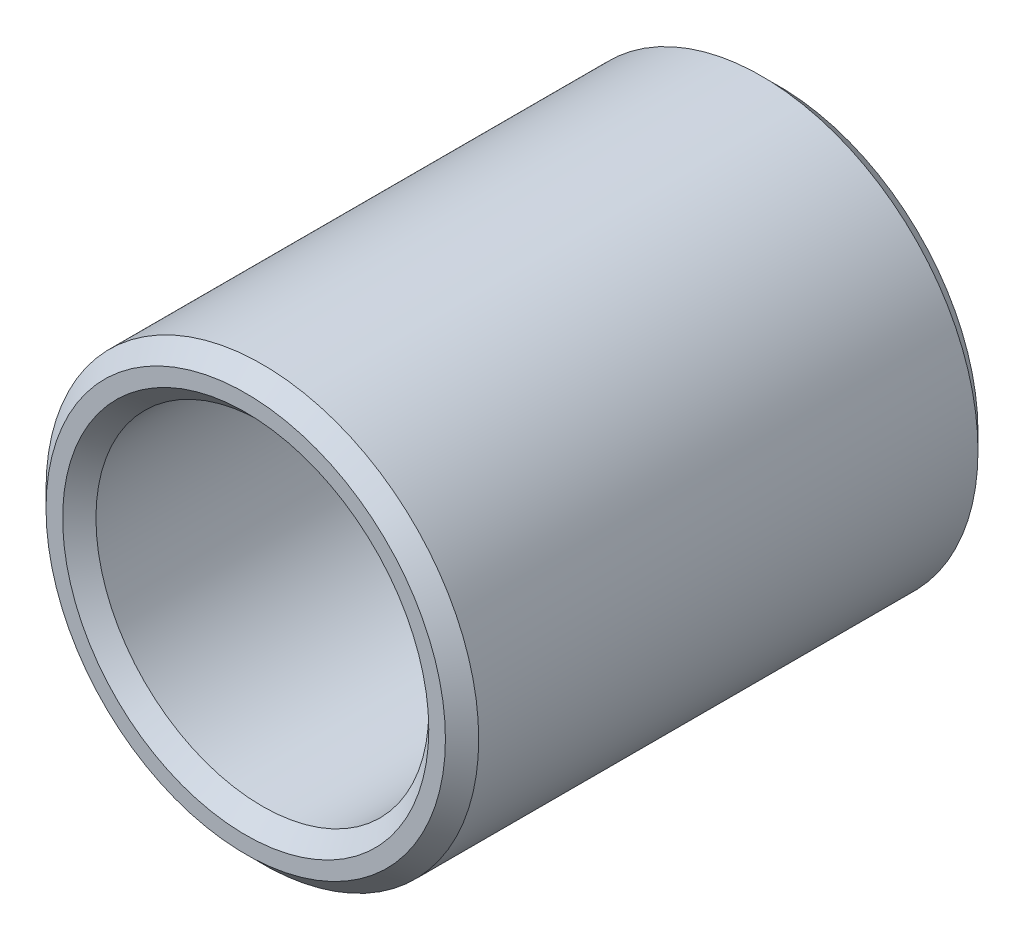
SolidWorks part; units mm, degrees
ref_plane "Plan de face" through (0, 0, 0) normal (0, 0, 1) x (1, 0, 0)
ref_plane "Plan de dessus" through (0, 0, 0) normal (0, 1, 0) x (1, 0, 0)
ref_plane "Plan de droite" through (0, 0, 0) normal (1, 0, 0) x (0, 0, -1)
sketch "Esquisse1" plane through (0, 0, 0) normal (0, 0, 1) x (1, 0, 0)
  circle A0 centre (0, 0) radius 10
  circle A1 centre (0, 0) radius 13
  dimension "D1" = 20
  dimension "D2" = 26
extrude "Extrusion1" add sketch "Esquisse1" along normal blind 32
chamfer "Chanfrein1" distance 1 angle 45 4 edges at (10, 0, 0) (13, 0, 0) (10, 0, 32) (13, 0, 32)
